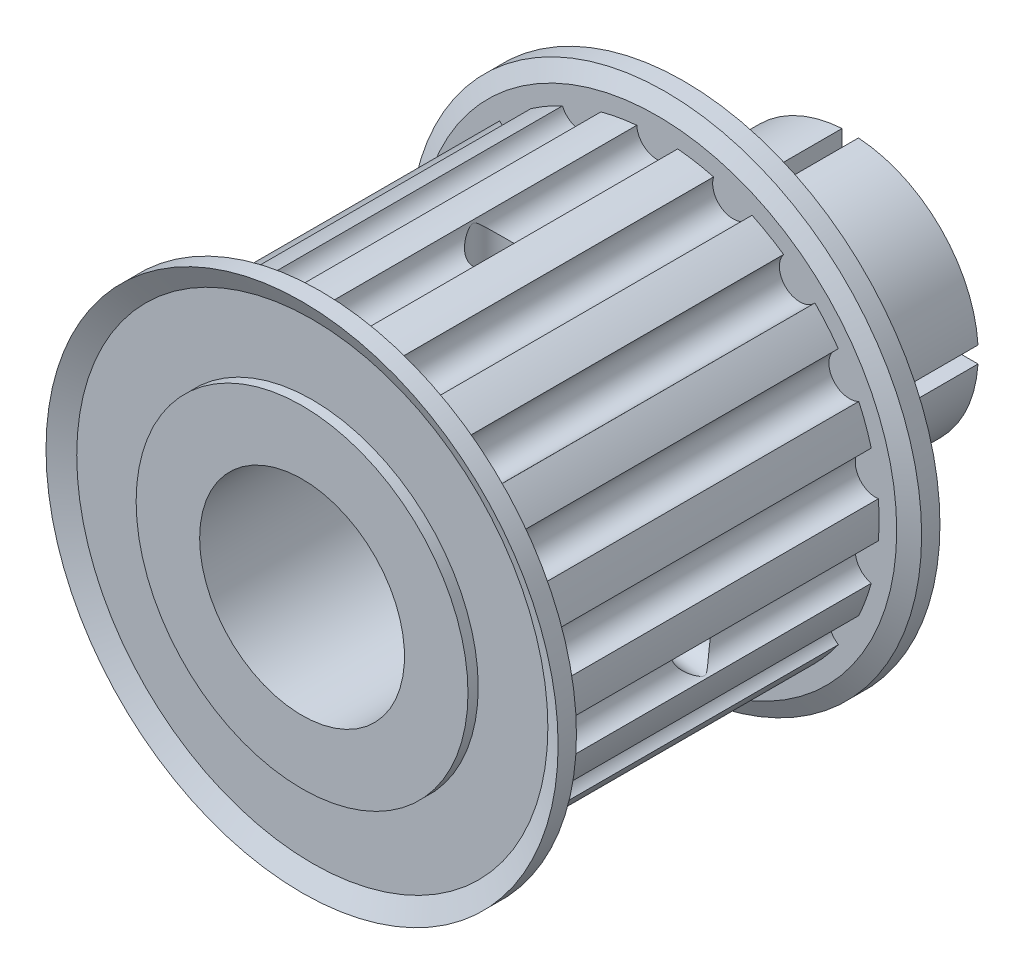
SolidWorks part; units mm, degrees
other "<21931112>-<Cut-Extrude3>" parameters "SLOT WIDTH"=1.016
ref_plane "Front" through (0, 0, 0) normal (0, 0, 1) x (1, 0, 0)
ref_plane "Top" through (0, 0, 0) normal (0, 1, 0) x (1, 0, 0)
ref_plane "Right" through (0, 0, 0) normal (1, 0, 0) x (0, 0, -1)
ref_plane "Z LocationM" through (0, 0, 35.6108) normal (0, 0, 1) x (1, 0, 0)
sketch "Y LocationM" plane through (0, 0, 35.6108) normal (0, 0, 1) x (1, 0, 0)
  line L0 (0, 0) -> (0, 81.2292) construction
  dimension "BD48" = 81.2292
ref_plane "Front-21931112" through (0, 81.2292, 35.6108) normal (0, 0, 1) x (1, 0, 0)
ref_plane "Top-21931112" through (0, 81.2292, 35.6108) normal (0, 1, 0) x (1, 0, 0)
ref_plane "Right-21931112" through (0, 81.2292, 35.6108) normal (1, 0, 0) x (0, 0, -1)
ref_plane "Plane1-21931112" through (0, 67.4751, 35.6108) normal (0, -1, 0) x (1, 0, 0)
inserted part "21931112"
move or copy body "Body-Move/Copy2"
other "Distance1" parameters "D1"=0
other "Distance2" parameters "D1"=11.8364
ref_plane "Ref OAL Pulley Width" through (0, 0, 23.7744) normal (0, 0, -1) x (-1, 0, 0)
ref_plane "OAL Pulley Width" through (0, 0, 57.7596) normal (0, 0, -1) x (-1, 0, 0)
sketch "Sketch2" plane through (0, 0, 66.4972) normal (0, 0, 1) x (1, 0, 0)
  line L0 (-15.875, 81.2292) -> (15.875, 81.2292) construction
  line L1 (15.875, 81.7372) -> (0.508, 81.7372)
  line L2 (15.875, 81.7372) -> (15.875, 80.7212)
  line L3 (15.875, 80.7212) -> (0.508, 80.7212)
  line L4 (-15.875, 81.7372) -> (-15.875, 80.7212)
  line L5 (0, 97.1042) -> (0, 65.3542) construction
  line L6 (-0.508, 81.7372) -> (-15.875, 81.7372)
  line L7 (-0.508, 80.7212) -> (-0.508, 65.3542)
  line L8 (-0.508, 80.7212) -> (-15.875, 80.7212)
  line L9 (-0.508, 97.1042) -> (0.508, 97.1042)
  line L10 (-0.508, 97.1042) -> (-0.508, 81.7372)
  line L11 (-0.508, 65.3542) -> (0.508, 65.3542)
  line L12 (0.508, 97.1042) -> (0.508, 81.7372)
  line L13 (0.508, 80.7212) -> (0.508, 65.3542)
  circle A1 centre (0, 81.2292) radius 15.875 construction
extrude "Extrude1" cut sketch "Sketch2" against normal blind 19.05
sketch "VAL Bore Dia Thru" plane through (0, 0, 23.7744) normal (0, 0, -1) x (-1, 0, 0)
  circle A0 centre (0, 81.2292) radius 6.35
  dimension "BD43" = 12.7
extrude "Bore Dia Thru" cut sketch "VAL Bore Dia Thru" against normal through all
sketch "VAL Collar Clamp OD" plane through (0, 0, 47.4472) normal (0, 0, -1) x (-1, 0, 0)
  arc A1 (10.2744, 81.7372) -> (0.508, 91.5036) centre (0, 81.2292) ccw construction
  circle A2 centre (0, 81.2292) radius 7.9375
  dimension "BD42" = 15.875
extrude "Collar Clamp OD" cut sketch "VAL Collar Clamp OD" against normal through all flip side to cut
sketch "Sketch4" plane through (0, 0, 66.4972) normal (0, 0, 1) x (1, 0, 0)
  circle A0 centre (0, 81.2292) radius 10.287
  circle A1 centre (0, 81.2292) radius 10.287 construction
extrude "Extrude3" cut sketch "Sketch4" against normal up to surface (8.7376 mm away)
move or copy body "Body-Move/Copy3" bodies to move or copy 104 copy no rotation origin (0, 81.2292, 35.6108) rotation axis (1, 0, 0) rotation angle 180
sketch "Sketch6" [suppressed] plane through (0, 0, 0) normal (1, 0, 0) x (0, 0, -1)
  line L0 (-78.9686, 81.2292) -> (-30.8299, 81.2292) construction
  line L1 (-47.4472, 81.7372) -> (-57.7596, 81.7372) construction
  line L2 (-57.7596, 80.7212) -> (-47.4472, 80.7212) construction
  line L3 (-45.7962, 90.4955) -> (-45.7962, 92.536) construction
  line L4 (-45.7962, 84.1787) -> (-67.2644, 84.1787)
  line L5 (-45.7962, 84.1787) -> (-45.7962, 93.1895)
  line L6 (-45.7962, 93.1895) -> (-67.2644, 93.1895)
  line L7 (-67.2644, 84.1787) -> (-67.2644, 93.1895)
  dimension "D1" = 0.508
  dimension "D2" = 0.508
revolve "Cut-Revolve2" [suppressed] cut sketch "Sketch6" angle 360 about L0
